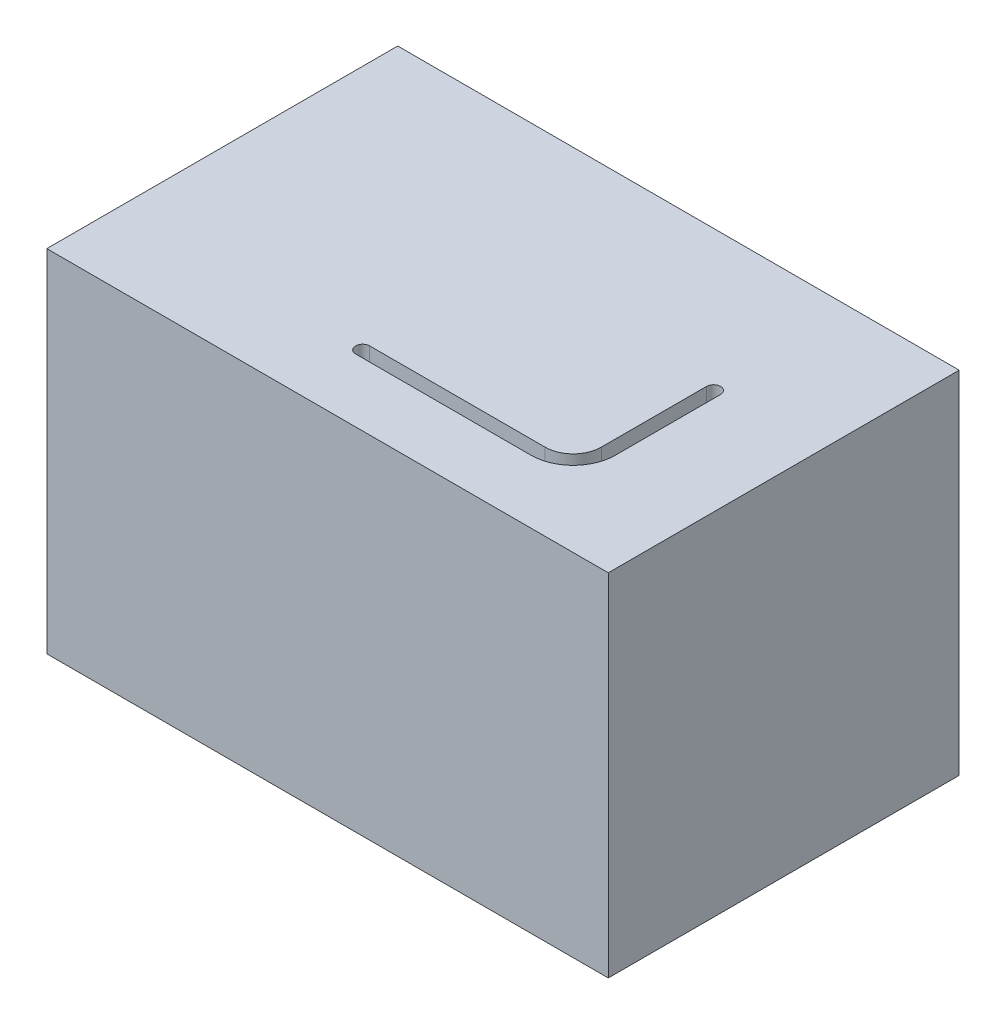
SolidWorks part; units mm, degrees
ref_plane "Front Plane" through (0, 0, 0) normal (0, 0, 1) x (1, 0, 0)
ref_plane "Top Plane" through (0, 0, 0) normal (0, 1, 0) x (1, 0, 0)
ref_plane "Right Plane" through (0, 0, 0) normal (1, 0, 0) x (0, 0, -1)
sketch "Sketch1" plane through (0, 0, 0) normal (0, 1, 0) x (1, 0, 0)
  line L0 (-101.6, 63.5) -> (101.6, -63.5) construction
  line L1 (-101.6, 63.5) -> (101.6, 63.5)
  line L2 (-101.6, 63.5) -> (-101.6, -63.5)
  line L3 (-101.6, -63.5) -> (101.6, -63.5)
  line L4 (101.6, 63.5) -> (101.6, -63.5)
  dimension "D1" = 203.2
  dimension "D2" = 127
extrude "Extrude1" add sketch "Sketch1" along normal mid plane 127
sketch "Sketch2" plane through (0, 63.5, 0) normal (0, 1, 0) x (-1, 0, 0)
  line L0 (12.7, 38.1) -> (-50.8, 38.1) construction
  line L1 (-63.5, 25.4) -> (-63.5, -12.7) construction
  line L2 (101.6, 63.5) -> (-101.6, 63.5) construction
  line L3 (-101.6, 63.5) -> (-101.6, -63.5) construction
  line L4 (12.7, 40.64) -> (-50.8, 40.64)
  line L5 (-66.04, 25.4) -> (-66.04, -12.7)
  line L6 (12.7, 35.56) -> (-50.8, 35.56)
  line L7 (-60.96, 25.4) -> (-60.96, -12.7)
  arc A0 (-50.8, 38.1) -> (-63.5, 25.4) centre (-50.8, 25.4) ccw construction
  arc A1 (-50.8, 40.64) -> (-66.04, 25.4) centre (-50.8, 25.4) ccw
  arc A2 (-50.8, 35.56) -> (-60.96, 25.4) centre (-50.8, 25.4) ccw
  arc A3 (12.7, 40.64) -> (12.7, 35.56) centre (12.7, 38.1) cw
  arc A4 (-66.04, -12.7) -> (-60.96, -12.7) centre (-63.5, -12.7) ccw
  point P5 (-63.5, 38.1)
  dimension "D3" = 12.7
  dimension "D1" = 76.2
  dimension "D2" = 50.8
  dimension "D4" = 25.4
  dimension "D5" = 38.1
  dimension "D6" = 2.54
  dimension "D7" = 2.54
extrude "Cut-Extrude1" cut sketch "Sketch2" against normal through all
sketch "Sketch4" plane through (32.8195, -27.472, -63.5) normal (0, 0, -1) x (-1, 0, 0)
  line L0 (59.2523, 47.5474) -> (-4.2477, 47.5474) construction
  line L1 (-16.9477, 34.8474) -> (-16.9477, -3.2526) construction
  line L4 (59.2523, 53.8974) -> (-4.2477, 53.8974)
  line L5 (-23.2977, 34.8474) -> (-23.2977, -3.2526)
  line L6 (59.2523, 41.1974) -> (-4.2477, 41.1974)
  line L7 (-10.5977, 34.8474) -> (-10.5977, -3.2526)
  arc A0 (-4.2477, 47.5474) -> (-16.9477, 34.8474) centre (-4.2477, 34.8474) ccw construction
  arc A1 (-4.2477, 53.8974) -> (-23.2977, 34.8474) centre (-4.2477, 34.8474) ccw
  arc A2 (-4.2477, 41.1974) -> (-10.5977, 34.8474) centre (-4.2477, 34.8474) ccw
  arc A3 (59.2523, 53.8974) -> (59.2523, 41.1974) centre (59.2523, 47.5474) cw
  arc A4 (-23.2977, -3.2526) -> (-10.5977, -3.2526) centre (-16.9477, -3.2526) ccw
  point P5 (-16.9477, 47.5474)
  dimension "D3" = 12.7
  dimension "D1" = 76.2
  dimension "D2" = 50.8
  dimension "D6" = 6.35
  dimension "D7" = 6.35
sketch "Sketch6" plane through (-101.6, 42.9111, -18.7503) normal (1, 0, 0) x (0, 1, 0)
  line L0 (12.7, 38.1) -> (-50.8, 38.1) construction
  line L1 (-63.5, 25.4) -> (-63.5, -12.7) construction
  line L4 (12.7, 40.64) -> (-50.8, 40.64)
  line L5 (-66.04, 25.4) -> (-66.04, -12.7)
  line L6 (12.7, 35.56) -> (-50.8, 35.56)
  line L7 (-60.96, 25.4) -> (-60.96, -12.7)
  arc A0 (-50.8, 38.1) -> (-63.5, 25.4) centre (-50.8, 25.4) ccw construction
  arc A1 (-50.8, 40.64) -> (-66.04, 25.4) centre (-50.8, 25.4) ccw
  arc A2 (-50.8, 35.56) -> (-60.96, 25.4) centre (-50.8, 25.4) ccw
  arc A3 (12.7, 40.64) -> (12.7, 35.56) centre (12.7, 38.1) cw
  arc A4 (-66.04, -12.7) -> (-60.96, -12.7) centre (-63.5, -12.7) ccw
  point P5 (-63.5, 38.1)
